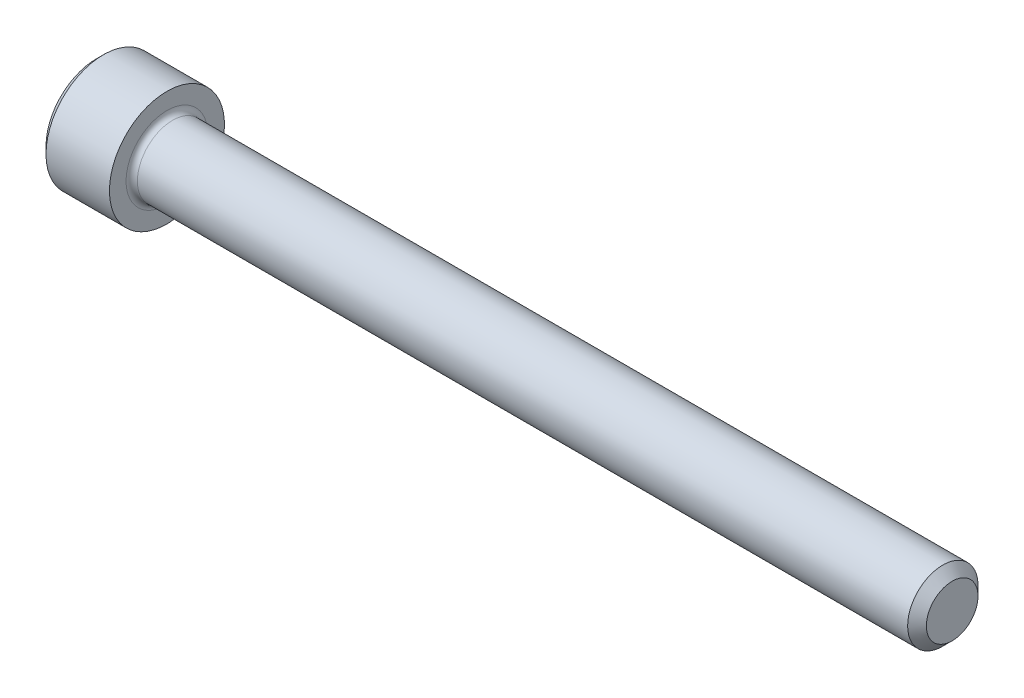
SolidWorks part; units mm, degrees
revolve "Base-Revolve" add sketch "BodySke"
sketch "BodySke" plane through (0, 0, 0) normal (0, 0, 1) x (1, 0, 0)
  line L0 (0, 0) -> (0, 2.0447)
  line L1 (0.2794, 2.3241) -> (2.8448, 2.3241)
  line L2 (2.8448, 2.3241) -> (2.8448, 1.4224)
  line L3 (2.8448, 1.4224) -> (34.2163, 1.4224)
  line L4 (34.5948, 1.0439) -> (34.5948, 0)
  line L5 (34.5948, 0) -> (0, 0)
  line L6 (-31.75, 0) -> (127, 0) construction
  line L7 (0, 2.0447) -> (0.2794, 2.3241)
  line L8 (34.5948, 1.0439) -> (34.2163, 1.4224)
  line L9 (0, -2.0447) -> (0.2794, -2.3241) construction
  line L10 (34.5948, -1.0439) -> (34.2163, -1.4224) construction
  line L11 (3.4798, 9.525) -> (3.4798, 3.175) construction
  line L12 (9.1948, 9.525) -> (9.1948, 3.175) construction
  line L13 (-3.5052, 9.525) -> (-3.5052, 3.175) construction
  dimension "Diameter" = 2.8448
  dimension "Head_ht" = 2.8448
  dimension "Length" = 31.75
  dimension "Body_ch_ang" = 45
  dimension "Head_dia" = 4.6482
  dimension "Head_ch_ang" = 45
  dimension "Head_side_ht" = 2.5654
  dimension "Minor_dia" = 2.0879
  dimension "Advance" = 0.635
  dimension "Thread_nom" = 25.4
  dimension "Thread_length" = 38.1
fillet "Fillet1" radius 0.2286 1 edges at (2.8448, 0, 1.4224)
ref_plane "Plane1" through (0, 0, 0) normal (0, 0, 1) x (1, 0, 0)
ref_plane "Plane2" through (0, 0, 0) normal (0, 1, 0) x (1, 0, 0)
ref_plane "Plane3" through (0, 0, 0) normal (1, 0, 0) x (0, 0, -1)
sketch "Sketch2" plane through (0, 0, 0) normal (0, 0, 1) x (1, 0, 0)
  line L0 (0, 1.1938) -> (1.2954, 1.1938)
  line L1 (1.2954, 1.1938) -> (1.9846, 0)
  line L2 (-31.75, 0) -> (127, 0) construction
  line L3 (1.9846, 0) -> (0, 0)
  line L4 (0, 0) -> (0, 1.1938)
  line L5 (0, 2.0447) -> (0, -2.0447) construction
  line L6 (0, 0) -> (47.625, 0) construction
  line L7 (2.8448, -2.3241) -> (2.8448, 2.3241) construction
revolve "Hex-PreBroach" cut sketch "Sketch2" angle 360 about L6
sketch "Sketch3" plane through (0, 0, 0) normal (-1, 0, 0) x (0, 0.5, 0.866)
  line L0 (0.6892, 1.1938) -> (-0.6892, 1.1938)
  line L1 (-0.6892, 1.1938) -> (-1.3785, 0)
  line L2 (0.6892, 1.1938) -> (1.3785, 0)
  line L3 (0.6892, -1.1938) -> (1.3785, 0)
  line L4 (0.6892, -1.1938) -> (-0.6892, -1.1938)
  line L5 (-0.6892, -1.1938) -> (-1.3785, 0)
extrude "Hex" cut sketch "Sketch3" against normal blind 1.2954
sketch "Sketch4" plane through (0, 0, 0) normal (-1, 0, 0) x (0, 0, 1)
  line L0 (0, 0) -> (1.4605, 0)
  line L1 (0, 0) -> (6.1484, 3.5498) construction
  line L2 (0, 0) -> (0.7302, 1.2648)
  line L3 (1.2009, 0.3267) -> (1.3933, 0.4378)
  line L4 (0.8834, 0.8767) -> (1.0758, 0.9877)
  arc A0 (1.2009, 0.3267) -> (0.8834, 0.8767) centre (0, 0) ccw
  arc A1 (1.4605, 0) -> (1.3933, 0.4378) centre (0, 0) ccw
  arc A2 (0.7302, 1.2648) -> (1.0758, 0.9877) centre (0, 0) cw
extrude "Spline" [suppressed] cut sketch "Sketch4" against normal blind 1.2954
pattern_circular "CirPattern1" [suppressed] count 6 every 60
sketch "Sketch5" plane through (0, 0, 0) normal (0, 0, 1) x (1, 0, 0)
  line L0 (-31.75, 0) -> (127, 0) construction
  line L2 (0, 2.0447) -> (0, -2.0447) construction
  circle A0 centre (1.016, 0) radius 0.4445
  dimension "Drilled_hole_dia" = 0.889
  dimension "Drilled_hole_loc" = 1.016
extrude "Hole" [suppressed] cut sketch "Sketch5" against normal through all and the other way through all
pattern_circular "Drilled-4" [suppressed] count 2 every 60
pattern_circular "Drilled-6" [suppressed] count 3 every 60
sketch "ThdSchSke" plane through (0, 0, 0) normal (0, 0, 1) x (1, 0, 0)
  line L0 (9.1948, -1.0439) -> (8.9298, -1.4224)
  line L1 (9.1948, -1.0439) -> (9.4598, -1.4224)
  line L2 (9.4598, -1.4224) -> (9.4598, -1.778)
  line L3 (-3.175, 0) -> (5.1513, 0) construction
  line L5 (9.4598, -1.778) -> (8.9298, -1.778)
  line L6 (8.9298, -1.778) -> (8.9298, -1.4224)
  line L7 (0, 2.0447) -> (0, -2.0447) construction
revolve "ThreadSchematic" [suppressed] cut sketch "ThdSchSke" angle 360 about L3
pattern_linear "ThdSchPat" [suppressed]
equation "\"D2@Sketch3\" = \"Hex_size@Sketch3\" / 2"
equation "\"D1@Sketch3\" = \"Hex_size@Sketch3\" / 2"
equation "\"D1@Sketch2\" = \"Hex_size@Sketch3\" / 2"
equation "\"D3@Sketch4\" = \"Spline_p_dim@Sketch4\" / 2"
equation "\"Thread_minor@ThreadCosmetic\"  =  \"Minor_dia@BodySke\""
equation "\"D2@CirPattern1\" = 360 / \"Num_teeth@CirPattern1\""
equation "\"Wall_thickness@Sketch2\" = \"Head_ht@BodySke\" - \"Key_eng@Hex\""
equation "\"Thread_length@ThreadCosmetic\" = ((sgn( (\"Length@BodySke\" - \"Advance@BodySke\" ) - \"Thread_nom@BodySke\" )-1)*( (\"Length@BodySke\" - \"Advance@BodySke\" ) - \"Thread_nom@BodySke\" ))/-2+ \"Thread_nom@BodySke\""
equation "\"Thread_minor@ThdSchSke\" = \"Minor_dia@BodySke\""
equation "\"Diameter@ThdSchSke\" = \"Diameter@BodySke\""
equation "\"Overcut@ThdSchSke\" = \"Diameter@BodySke\" * 1.25"
equation "\"Start@ThdSchSke\" = \"Head_ht@BodySke\" + \"Length@BodySke\" - \"Thread_length@ThreadCosmetic\"  '---Non-countersunk---"
equation "\"Num_threads@ThdSchPat\" = int( \"Thread_length@ThreadCosmetic\" / \"Advance@BodySke\" + 0.999 )  + 1"
equation "\"Advance@ThdSchPat\" = \"Thread_length@ThreadCosmetic\" /  (\"Num_threads@ThdSchPat\" - 1) 'relax it"
equation "\"Num_threads@ThdSchPat\" = \"Num_threads@ThdSchPat\" - sgn( \"Num_threads@ThdSchPat\" - 1) '---chamfered tips only---"
